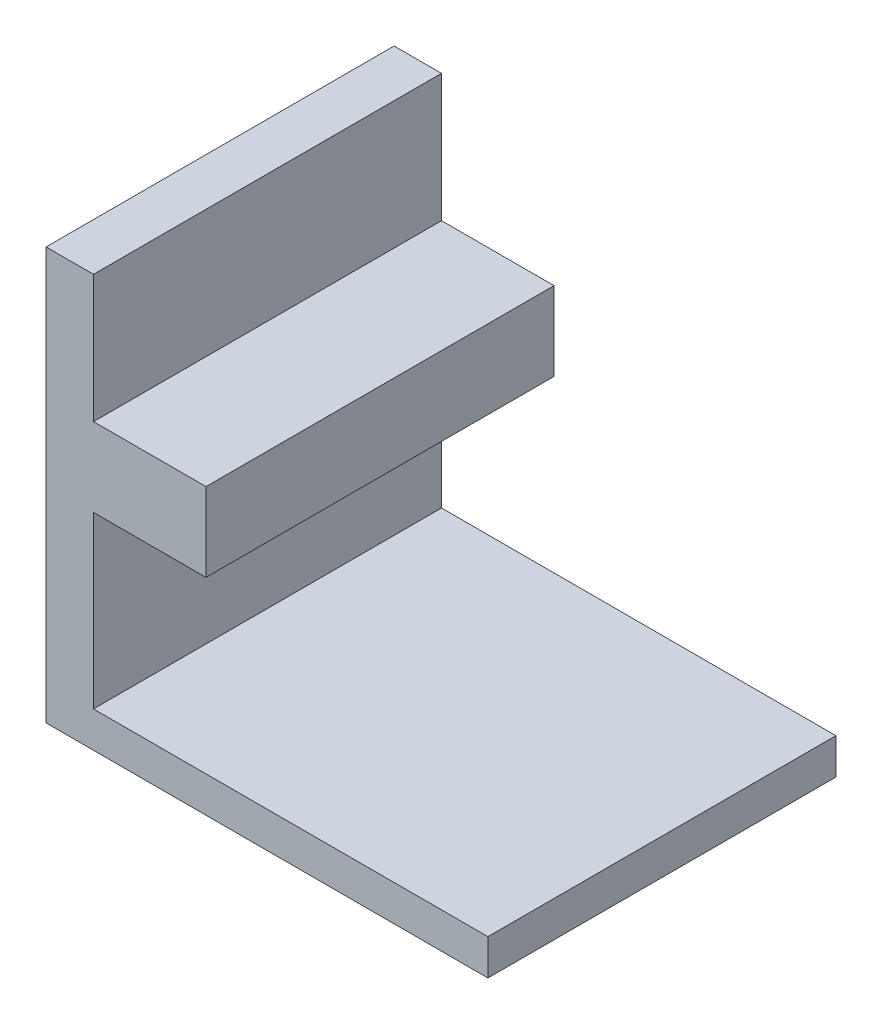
SolidWorks part; units mm, degrees
ref_plane "Front Plane" through (0, 0, 0) normal (0, 0, 1) x (1, 0, 0)
ref_plane "Top Plane" through (0, 0, 0) normal (0, 1, 0) x (1, 0, 0)
ref_plane "Right Plane" through (0, 0, 0) normal (1, 0, 0) x (0, 0, -1)
sketch "Sketch1" plane through (0, 0, 0) normal (0, 0, 1) x (1, 0, 0)
  line L0 (0, 157.5143) -> (0, 0)
  line L1 (0, 0) -> (168.8397, 0)
  line L2 (168.8397, 0) -> (168.8397, 13.6845)
  line L3 (168.8397, 13.6845) -> (18.1175, 13.6845)
  line L4 (18.1175, 13.6845) -> (18.1175, 157.5143)
  line L5 (18.1175, 157.5143) -> (0, 157.5143)
extrude "Boss-Extrude1" add sketch "Sketch1" along normal mid plane 133
sketch "Sketch3" plane through (18.1175, 0, 0) normal (1, 0, 0) x (0, 0, -1)
  line L0 (-66.5, 13.6845) -> (-66.5, 157.5143) construction
  line L1 (-66.5, 108.7619) -> (66.5, 108.7619)
  line L2 (-66.5, 108.7619) -> (-66.5, 78.7189)
  line L3 (-66.5, 78.7189) -> (66.5, 78.7189)
  line L4 (66.5, 108.7619) -> (66.5, 78.7189)
  line L5 (66.5, 13.6845) -> (66.5, 157.5143) construction
extrude "Boss-Extrude2" add sketch "Sketch3" along normal blind 43
sketch "Sketch2" plane through (0, 13.6845, 0) normal (0, 1, 0) x (-1, 0, 0)
  line L0 (-168.8397, -66.5) -> (-18.1175, -66.5) construction
  line L3 (-168.8397, 66.5) -> (-146.2794, 66.5)
  line L4 (-168.8397, 66.5) -> (-168.8397, -66.5)
  line L5 (-168.8397, -66.5) -> (-146.2794, -66.5)
  line L6 (-146.2794, 66.5) -> (-146.2794, -66.5)
